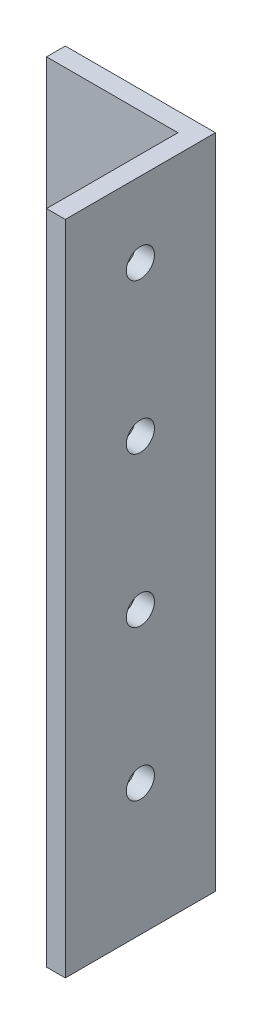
SolidWorks part; units mm, degrees
ref_plane "Front Plane" through (0, 0, 0) normal (0, 0, 1) x (1, 0, 0)
ref_plane "Top Plane" through (0, 0, 0) normal (0, 1, 0) x (1, 0, 0)
ref_plane "Right Plane" through (0, 0, 0) normal (1, 0, 0) x (0, 0, -1)
sketch "Sketch2" plane through (0, 0, 0) normal (0, 1, 0) x (1, 0, 0)
  line L0 (-9.525, 9.525) -> (9.525, 9.525)
  line L1 (9.525, -12.7) -> (12.7, -12.7)
  line L2 (-12.7, 9.525) -> (-12.7, 12.7)
  line L3 (-12.7, 12.7) -> (12.7, 12.7)
  line L4 (12.7, -12.7) -> (12.7, 12.7)
  line L5 (-12.7, -12.7) -> (12.7, 12.7) construction
  line L6 (-12.7, 12.7) -> (12.7, -12.7) construction
  line L7 (9.525, -9.525) -> (9.525, 9.525)
  line L10 (-9.525, 9.525) -> (-12.7, 9.525)
  line L11 (9.525, -9.525) -> (9.525, -12.7)
  line L12 (-12.7, -12.7) -> (12.7, -12.7) construction
  line L13 (-12.7, -12.7) -> (-12.7, 12.7) construction
  line L14 (-9.525, -9.525) -> (-9.525, 9.525) construction
  line L15 (-9.525, -9.525) -> (9.525, -9.525) construction
  point P0 (0, 0)
  dimension "D2" = 25.4
  dimension "D1" = 3.175
extrude "Boss-Extrude1" add sketch "Sketch2" along normal blind 111.1098
sketch "Sketch4" plane through (12.7, 0, 0) normal (1, 0, 0) x (0, 0, -1)
  line L0 (0, 111.1098) -> (0, 0) construction
  line L1 (-12.7, 111.1098) -> (12.7, 111.1098) construction
  circle A0 centre (0, 98.4098) radius 2.3812
  dimension "D1" = 4.7625
  dimension "D2" = 12.7
extrude "Cut-Extrude2" cut sketch "Sketch4" against normal through all
pattern_linear "LPattern2" count 4 spacing 25.4 along (0, -1, 0) of "Cut-Extrude2"
